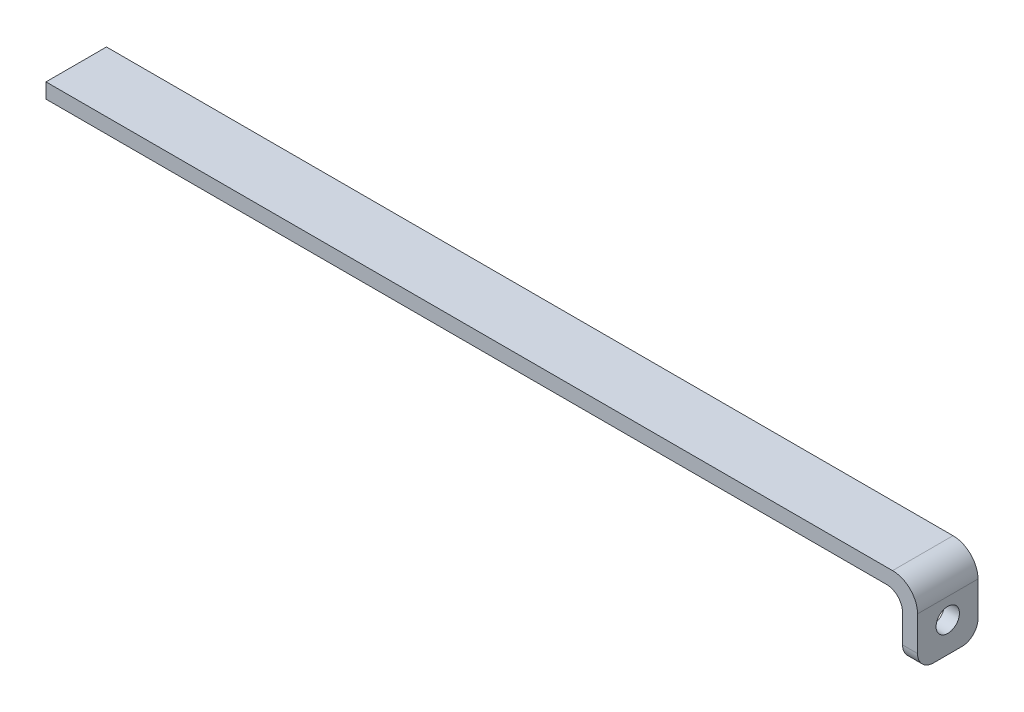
SolidWorks part; units mm, degrees
ref_plane "Front Plane" through (0, 0, 0) normal (0, 0, 1) x (1, 0, 0)
ref_plane "Top Plane" through (0, 0, 0) normal (0, 1, 0) x (1, 0, 0)
ref_plane "Right Plane" through (0, 0, 0) normal (1, 0, 0) x (0, 0, -1)
sketch "Sketch1" plane through (0, 0, 0) normal (0, 1, 0) x (1, 0, 0)
  line L1 (-4.7625, -4.7625) -> (130.1623, -4.7625)
  line L2 (-4.7625, -4.7625) -> (-4.7625, 4.7625)
  line L3 (-4.7625, 4.7625) -> (130.1623, 4.7625)
  line L4 (130.1623, -4.7625) -> (130.1623, 4.7625)
  dimension "D1" = 134.9248
  dimension "D2" = 4.7625
  dimension "D3" = 9.525
  dimension "D4" = 4.7625
extrude "Boss-Extrude1" add sketch "Sketch1" against normal blind 2.3622
sketch "Sketch2" plane through (130.1623, 0, 0) normal (1, 0, 0) x (0, 0, -1)
  line L0 (4.7625, -2.3622) -> (4.7625, 0) construction
  line L1 (-4.7625, 0) -> (4.7625, 0)
  line L2 (-4.7625, 0) -> (-4.7625, -11.8872)
  line L3 (-4.7625, -11.8872) -> (4.7625, -11.8872)
  line L4 (4.7625, 0) -> (4.7625, -11.8872)
  line L5 (-4.7625, -2.3622) -> (4.7625, -2.3622) construction
  dimension "D1" = 9.525
extrude "Boss-Extrude2" add sketch "Sketch2" along normal blind 2.3622
sketch "Sketch3" plane through (132.5245, 0, 0) normal (1, 0, 0) x (0, 0, -1)
  line L0 (-4.7625, -11.8872) -> (4.7625, -11.8872) construction
  line L1 (-4.7625, 0) -> (-4.7625, -11.8872) construction
  circle A0 centre (0, -7.1374) radius 1.8415
  dimension "D1" = 3.683
  dimension "D2" = 4.7498
  dimension "D3" = 4.7625
extrude "Cut-Extrude1" cut sketch "Sketch3" against normal through all
fillet "Fillet1" radius 2.54 3 edges at (131.3434, -11.8872, -4.7625) (131.3434, -11.8872, 4.7625) (130.1623, -2.3622, 0)
fillet "Fillet2" radius 3.937 1 edges at (132.5245, 0, 0)
